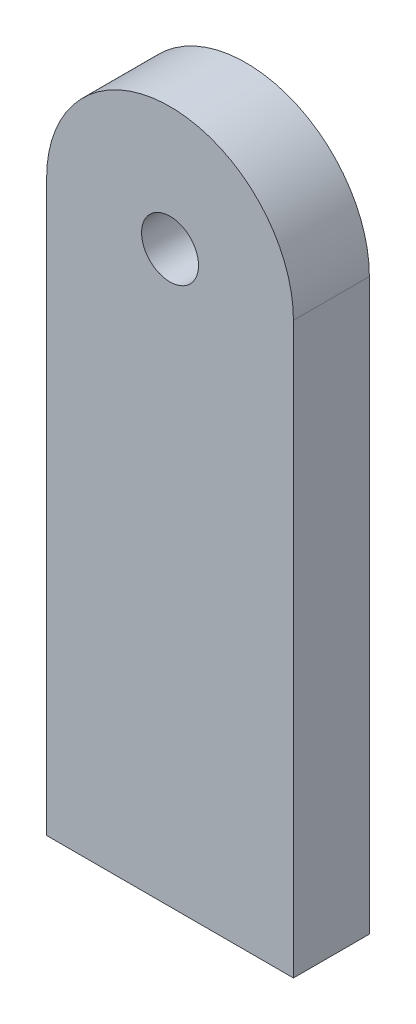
SolidWorks part; units mm, degrees
ref_plane "Front Plane" through (0, 0, 0) normal (0, 0, 1) x (1, 0, 0)
ref_plane "Top Plane" through (0, 0, 0) normal (0, 1, 0) x (1, 0, 0)
ref_plane "Right Plane" through (0, 0, 0) normal (1, 0, 0) x (0, 0, -1)
sketch "Sketch1" plane through (0, 0, 0) normal (0, 0, 1) x (1, 0, 0)
  line L0 (-16.51, 0) -> (-16.51, -76.2)
  line L1 (16.51, 0) -> (16.51, -76.2)
  line L2 (16.51, -76.2) -> (-16.51, -76.2)
  circle A0 centre (0, 0) radius 3.81
  arc A1 (16.51, 0) -> (-16.51, 0) centre (0, 0) ccw
  dimension "D1" = 7.62
  dimension "D2" = 16.51
  dimension "D3" = 76.2
extrude "Extrude1" add sketch "Sketch1" along normal mid plane 10.16
